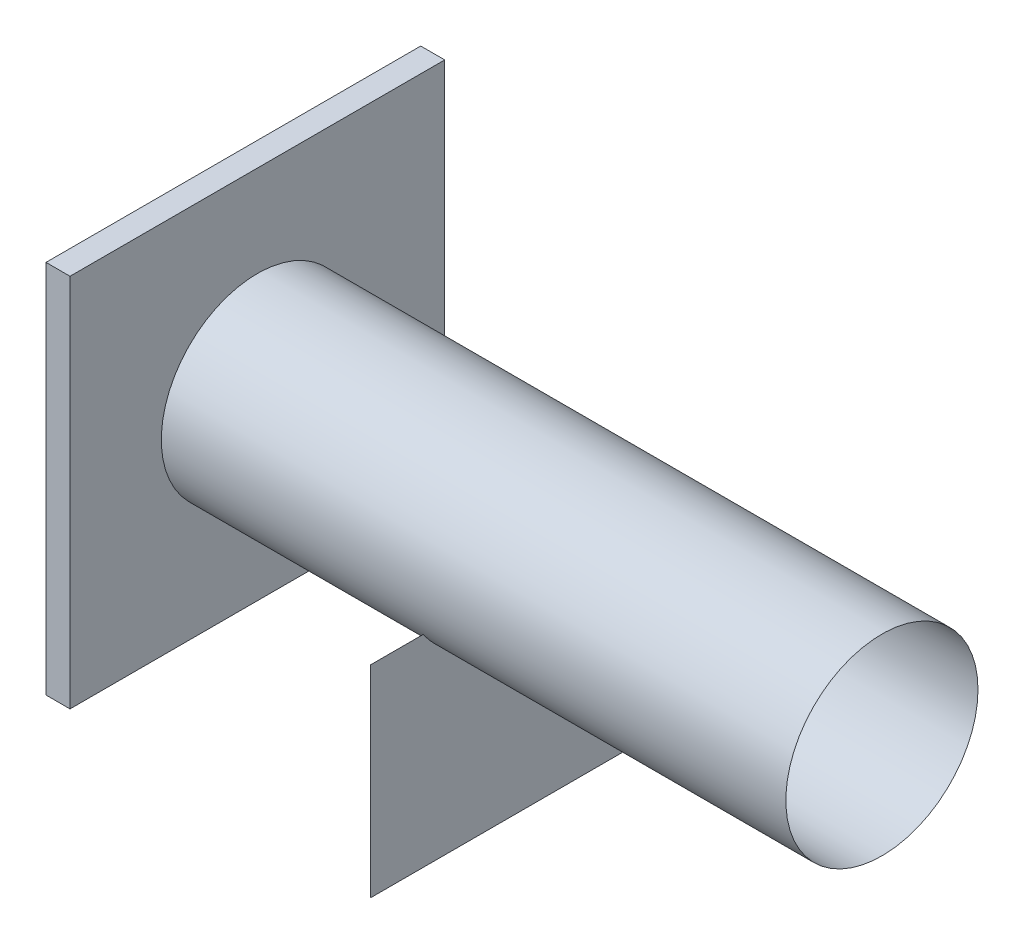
SolidWorks part; units mm, degrees
ref_plane "Front Plane" through (0, 0, 0) normal (0, 0, 1) x (1, 0, 0)
ref_plane "Top Plane" through (0, 0, 0) normal (0, 1, 0) x (1, 0, 0)
ref_plane "Right Plane" through (0, 0, 0) normal (1, 0, 0) x (0, 0, -1)
sketch "Sketch1" plane through (0, 0, 0) normal (1, 0, 0) x (0, 0, -1)
  circle A0 centre (0, 0) radius 200
surface "Surface-Extrude1" sketch "Sketch1" parameters "D1"=1300
ref_plane "Plane1" through (510, 0, 0) normal (1, 0, 0) x (0, 0, -1)
sketch "Sketch2" plane through (510, 0, 0) normal (1, 0, 0) x (0, 0, -1)
  line L0 (0, 0) -> (0, -533.2906) construction
  line L1 (-275, -113.2906) -> (-164.8188, -113.2906)
  line L2 (-275, -113.2906) -> (-275, -533.2906)
  line L3 (-275, -533.2906) -> (275, -533.2906)
  line L4 (275, -113.2906) -> (275, -533.2906)
  line L5 (164.8188, -113.2906) -> (275, -113.2906)
  circle A0 centre (0, 0) radius 200 construction
  arc A1 (-164.8188, -113.2906) -> (164.8188, -113.2906) centre (0, 0) ccw
  dimension "D1" = 550
  dimension "D2" = 420
surface "Surface-Plane1" sketch "Sketch2"
ref_plane "Plane3" through (0, 0, 0) normal (1, 0, 0) x (0, 0, -1)
sketch "Sketch4" plane through (0, 0, 0) normal (1, 0, 0) x (0, 0, -1)
  line L1 (390, -390) -> (-390, -390)
  line L2 (390, -390) -> (390, 390)
  line L3 (390, 390) -> (-390, 390)
  line L4 (-390, -390) -> (-390, 390)
  line L5 (390, -390) -> (-390, 390) construction
  line L6 (390, 390) -> (-390, -390) construction
  circle A0 centre (0, 0) radius 190
  dimension "D1" = 780
  dimension "D2" = 780
extrude "Boss-Extrude1" add sketch "Sketch4" against normal blind 50
